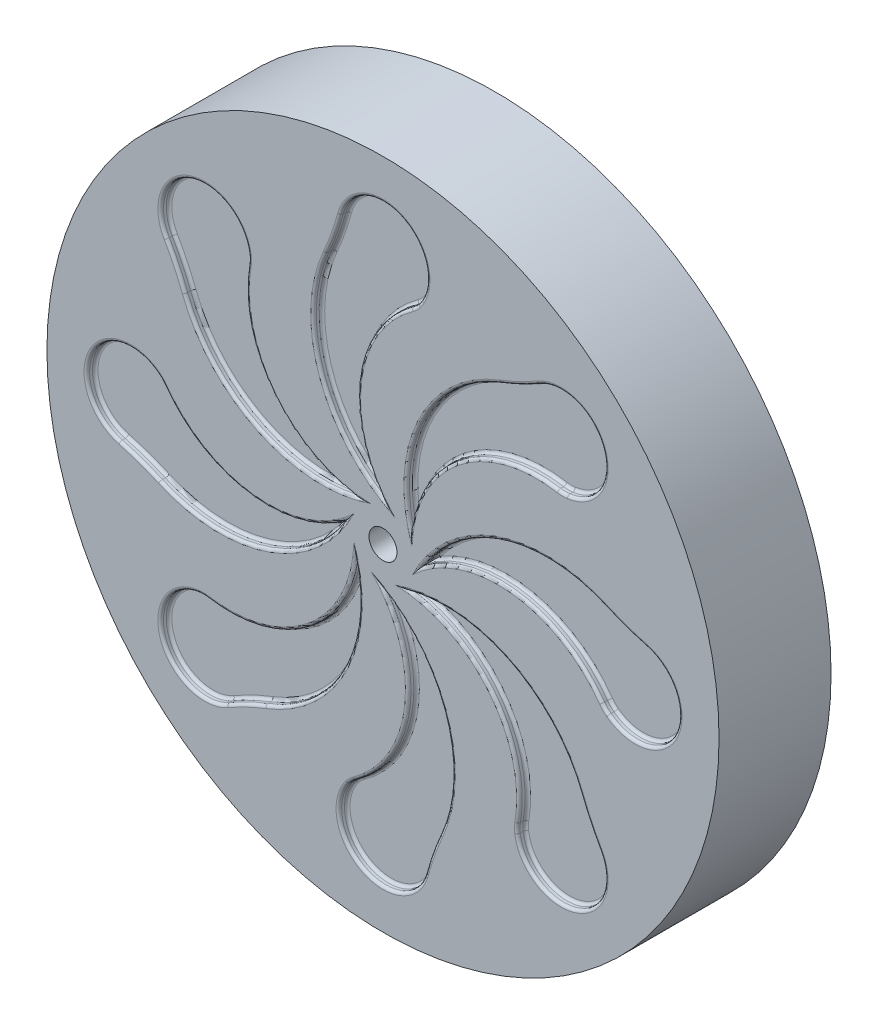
SolidWorks part; units mm, degrees
ref_plane "Front Plane" through (0, 0, 0) normal (0, 0, 1) x (1, 0, 0)
ref_plane "Top Plane" through (0, 0, 0) normal (0, 1, 0) x (1, 0, 0)
ref_plane "Right Plane" through (0, 0, 0) normal (1, 0, 0) x (0, 0, -1)
sketch "Sketch1" plane through (0, 0, 0) normal (0, 0, 1) x (1, 0, 0)
  circle A0 centre (0, 0) radius 304.8
  circle A1 centre (0, 0) radius 12.7
  dimension "D1" = 609.6
  dimension "D2" = 25.4
extrude "Boss-Extrude1" add sketch "Sketch1" along normal blind 101.6
sketch "Sketch2" plane through (0, 0, 101.6) normal (0, 0, 1) x (1, 0, 0)
  line L0 (0, 0) -> (0, 453.2668) construction
  arc A0 (-38.689, 238.8422) -> (31.8583, 204.3763) centre (0, 228.6) cw
  arc A1 (-38.689, 238.8422) -> (-51.5113, 202.4827) centre (-271.1744, 300.3882) cw
  arc A2 (31.8583, 204.3763) -> (25.8337, 198.5555) centre (9.9107, 221.0643) cw
  arc A3 (-51.5113, 202.4827) -> (0, 35.338) centre (69.8721, 148.3812) ccw
  arc A4 (25.8337, 198.5555) -> (0, 35.338) centre (92.4727, 104.3548) ccw
  dimension "D1" = 228.6
extrude "Cut-Extrude1" cut sketch "Sketch2" against normal blind 7.62
pattern_circular "CirPattern1" count 8 every 45 about axis through (0, 0, 0) along (0, 0, 1) of "Cut-Extrude1"
fillet "Fillet1" radius 2.54 10 edges at (-21.4971, 122.3937, 101.6) (29.0684, 201.2358, 101.6) (-57.1279, 109.2419, 101.6) (-44.3704, 220.4051, 101.6) (-57.1279, 109.2419, 93.98) (-44.3704, 220.4051, 93.98) (17.5681, 264.5597, 93.98) (29.0684, 201.2358, 93.98) (17.5681, 264.5597, 101.6) (-21.4971, 122.3937, 93.98)
fillet "Fillet2" radius 2.54 70 edges at (21.4971, -122.3937, 93.98) (-29.0684, -201.2358, 93.98) (-17.5681, -264.5597, 93.98) (57.1279, -109.2419, 93.98) (21.4971, -122.3937, 101.6) (-29.0684, -201.2358, 101.6) (-17.5681, -264.5597, 101.6) (57.1279, -109.2419, 101.6) (-101.7462, 71.3447, 93.98) (-121.7407, 162.8496, 93.98) (-117.6412, 36.8502, 93.98) (-187.2245, 124.4753, 93.98) (-101.7462, 71.3447, 101.6) (-121.7407, 162.8496, 101.6) (-117.6412, 36.8502, 101.6) (-187.2245, 124.4753, 101.6) (-109.2419, -57.1279, 93.98) (-220.4051, -44.3704, 93.98) (-264.5597, 17.5681, 93.98) (-201.2358, 29.0684, 93.98) (-109.2419, -57.1279, 101.6) (-220.4051, -44.3704, 101.6) (-264.5597, 17.5681, 101.6) (-201.2358, 29.0684, 101.6) (-36.8502, -117.6412, 93.98) (-124.4753, -187.2245, 93.98) (-199.4945, -174.6494, 93.98) (-162.8496, -121.7407, 93.98) (-36.8502, -117.6412, 101.6) (-124.4753, -187.2245, 101.6) (-199.4945, -174.6494, 101.6) (-162.8496, -121.7407, 101.6) (101.7462, -71.3447, 93.98) (121.7407, -162.8496, 93.98) (174.6494, -199.4945, 93.98) (187.2245, -124.4753, 93.98) (101.7462, -71.3447, 101.6) (121.7407, -162.8496, 101.6) (174.6494, -199.4945, 101.6) (187.2245, -124.4753, 101.6) (122.3937, 21.4971, 101.6) (201.2358, -29.0684, 101.6) (109.2419, 57.1279, 101.6) (220.4051, 44.3704, 101.6) (122.3937, 21.4971, 93.98) (201.2358, -29.0684, 93.98) (109.2419, 57.1279, 93.98) (220.4051, 44.3704, 93.98) (71.3447, 101.7462, 93.98) (162.8496, 121.7407, 93.98) (36.8502, 117.6412, 93.98) (124.4753, 187.2245, 93.98) (71.3447, 101.7462, 101.6) (162.8496, 121.7407, 101.6) (36.8502, 117.6412, 101.6) (124.4753, 187.2245, 101.6) (44.3704, -220.4051, 93.98) (44.3704, -220.4051, 101.6) (-174.6494, 199.4945, 93.98) (-174.6494, 199.4945, 101.6) (-122.3937, -21.4971, 93.98) (-122.3937, -21.4971, 101.6) (-71.3447, -101.7462, 93.98) (-71.3447, -101.7462, 101.6) (117.6412, -36.8502, 93.98) (117.6412, -36.8502, 101.6) (264.5597, -17.5681, 101.6) (264.5597, -17.5681, 93.98) (199.4945, 174.6494, 93.98) (199.4945, 174.6494, 101.6)
